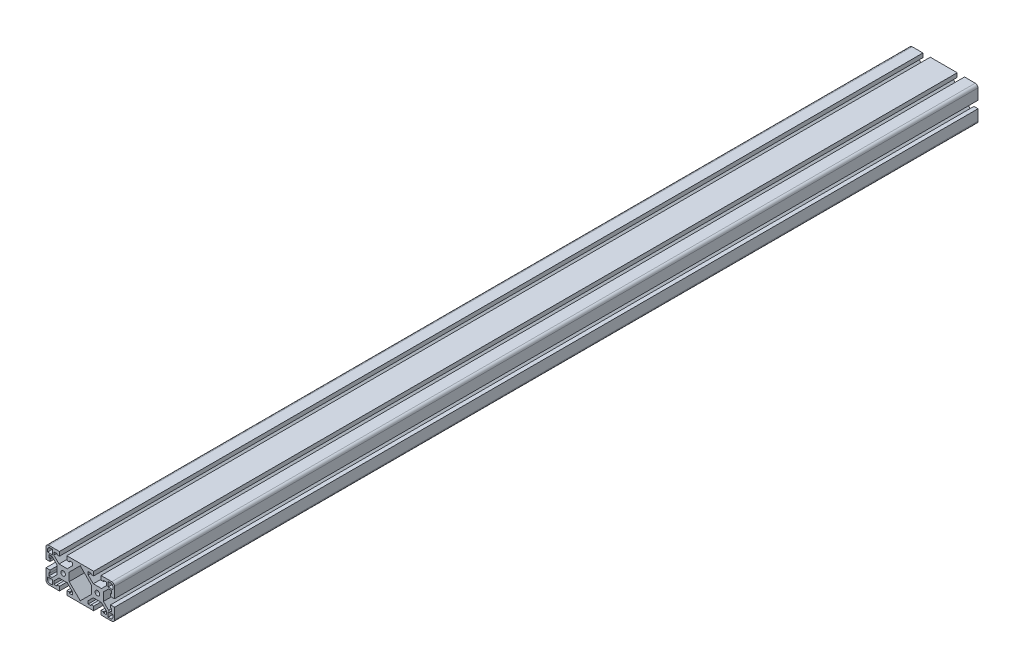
SolidWorks part; units mm, degrees
ref_plane "Front" through (0, 0, 0) normal (0, 0, 1) x (1, 0, 0)
ref_plane "Top" through (0, 0, 0) normal (0, 1, 0) x (1, 0, 0)
ref_plane "Right" through (0, 0, 0) normal (1, 0, 0) x (0, 0, -1)
sketch "Sketch1" plane through (0, 0, 0) normal (0, 0, 1) x (1, 0, 0)
  line L0 (-12.319, 4.5757) -> (-12.319, -4.5757)
  line L1 (0, 16.8947) -> (-12.319, 4.5757)
  line L2 (12.319, 4.5757) -> (0, 16.8947)
  line L3 (12.319, -4.5757) -> (12.319, 4.5757)
  line L4 (0, -16.8947) -> (12.319, -4.5757)
  line L5 (-12.319, -4.5757) -> (0, -16.8947)
  line L6 (-30.9372, 11.8872) -> (-30.9372, 17.272)
  line L7 (-36.322, 11.8872) -> (-30.9372, 11.8872)
  line L8 (-36.322, 14.478) -> (-36.322, 11.8872)
  line L9 (-30.9372, 17.272) -> (-33.528, 17.272)
  line L10 (-30.9372, -17.272) -> (-30.9372, -11.8872)
  line L11 (-33.528, -17.272) -> (-30.9372, -17.272)
  line L12 (-36.322, -11.8872) -> (-36.322, -14.478)
  line L13 (-30.9372, -11.8872) -> (-36.322, -11.8872)
  line L14 (36.322, -11.8872) -> (30.9372, -11.8872)
  line L15 (36.322, -14.478) -> (36.322, -11.8872)
  line L16 (30.9372, -17.272) -> (33.528, -17.272)
  line L17 (30.9372, -11.8872) -> (30.9372, -17.272)
  line L18 (30.9372, 17.272) -> (30.9372, 11.8872)
  line L19 (33.528, 17.272) -> (30.9372, 17.272)
  line L20 (36.322, 11.8872) -> (36.322, 14.478)
  line L21 (30.9372, 11.8872) -> (36.322, 11.8872)
  line L22 (-29.337, 12.4423) -> (-29.337, 15.6718)
  line L23 (-29.337, 15.6718) -> (-25.908, 15.6718)
  line L24 (-25.908, 15.6718) -> (-25.908, 14.5034)
  line L25 (-25.908, 14.5034) -> (-23.114, 14.5034)
  line L26 (-23.114, 14.5034) -> (-23.114, 19.05)
  line L27 (-23.114, 19.05) -> (-35.052, 19.05)
  line L28 (-38.1, 16.002) -> (-38.1, 4.064)
  line L29 (-38.1, 4.064) -> (-33.5534, 4.064)
  line L30 (-33.5534, 4.064) -> (-33.5534, 6.858)
  line L31 (-33.5534, 6.858) -> (-34.7218, 6.858)
  line L32 (-34.7218, 6.858) -> (-34.7218, 10.287)
  line L33 (-34.7218, 10.287) -> (-31.4923, 10.287)
  line L34 (-31.4923, 10.287) -> (-25.781, 4.5757)
  line L35 (-25.781, 4.5757) -> (-25.781, -4.5757)
  line L36 (-25.781, -4.5757) -> (-31.4923, -10.287)
  line L37 (-31.4923, -10.287) -> (-34.7218, -10.287)
  line L38 (-34.7218, -10.287) -> (-34.7218, -6.858)
  line L39 (-34.7218, -6.858) -> (-33.5534, -6.858)
  line L40 (-33.5534, -6.858) -> (-33.5534, -4.064)
  line L41 (-33.5534, -4.064) -> (-38.1, -4.064)
  line L42 (-38.1, -4.064) -> (-38.1, -16.002)
  line L43 (-35.052, -19.05) -> (-23.114, -19.05)
  line L44 (-23.114, -19.05) -> (-23.114, -14.5034)
  line L45 (-23.114, -14.5034) -> (-25.908, -14.5034)
  line L46 (-25.908, -14.5034) -> (-25.908, -15.6718)
  line L47 (-25.908, -15.6718) -> (-29.337, -15.6718)
  line L48 (-29.337, -15.6718) -> (-29.337, -12.4423)
  line L49 (-29.337, -12.4423) -> (-23.6257, -6.731)
  line L50 (-23.6257, -6.731) -> (-14.4743, -6.731)
  line L51 (-14.4743, -6.731) -> (-8.763, -12.4423)
  line L52 (-8.763, -12.4423) -> (-8.763, -15.6718)
  line L53 (-8.763, -15.6718) -> (-12.192, -15.6718)
  line L54 (-12.192, -15.6718) -> (-12.192, -14.5034)
  line L55 (-12.192, -14.5034) -> (-14.986, -14.5034)
  line L56 (-14.986, -14.5034) -> (-14.986, -19.05)
  line L57 (-14.986, -19.05) -> (14.986, -19.05)
  line L58 (14.986, -19.05) -> (14.986, -14.5034)
  line L59 (14.986, -14.5034) -> (12.192, -14.5034)
  line L60 (12.192, -14.5034) -> (12.192, -15.6718)
  line L61 (12.192, -15.6718) -> (8.763, -15.6718)
  line L62 (8.763, -15.6718) -> (8.763, -12.4423)
  line L63 (8.763, -12.4423) -> (14.4743, -6.731)
  line L64 (14.4743, -6.731) -> (23.6257, -6.731)
  line L65 (23.6257, -6.731) -> (29.337, -12.4423)
  line L66 (29.337, -12.4423) -> (29.337, -15.6718)
  line L67 (29.337, -15.6718) -> (25.908, -15.6718)
  line L68 (25.908, -15.6718) -> (25.908, -14.5034)
  line L69 (25.908, -14.5034) -> (23.114, -14.5034)
  line L70 (23.114, -14.5034) -> (23.114, -19.05)
  line L71 (23.114, -19.05) -> (35.052, -19.05)
  line L72 (38.1, -16.002) -> (38.1, -4.064)
  line L73 (38.1, -4.064) -> (33.5534, -4.064)
  line L74 (33.5534, -4.064) -> (33.5534, -6.858)
  line L75 (33.5534, -6.858) -> (34.7218, -6.858)
  line L76 (34.7218, -6.858) -> (34.7218, -10.287)
  line L77 (34.7218, -10.287) -> (31.4923, -10.287)
  line L78 (31.4923, -10.287) -> (25.781, -4.5757)
  line L79 (25.781, -4.5757) -> (25.781, 4.5757)
  line L80 (25.781, 4.5757) -> (31.4923, 10.287)
  line L81 (31.4923, 10.287) -> (34.7218, 10.287)
  line L82 (34.7218, 10.287) -> (34.7218, 6.858)
  line L83 (34.7218, 6.858) -> (33.5534, 6.858)
  line L84 (33.5534, 6.858) -> (33.5534, 4.064)
  line L85 (33.5534, 4.064) -> (38.1, 4.064)
  line L86 (38.1, 4.064) -> (38.1, 16.002)
  line L87 (35.052, 19.05) -> (23.114, 19.05)
  line L88 (23.114, 19.05) -> (23.114, 14.5034)
  line L89 (23.114, 14.5034) -> (25.908, 14.5034)
  line L90 (25.908, 14.5034) -> (25.908, 15.6718)
  line L91 (25.908, 15.6718) -> (29.337, 15.6718)
  line L92 (29.337, 15.6718) -> (29.337, 12.4423)
  line L93 (29.337, 12.4423) -> (23.6257, 6.731)
  line L94 (23.6257, 6.731) -> (14.4743, 6.731)
  line L95 (14.4743, 6.731) -> (8.763, 12.4423)
  line L96 (8.763, 12.4423) -> (8.763, 15.6718)
  line L97 (8.763, 15.6718) -> (12.192, 15.6718)
  line L98 (12.192, 15.6718) -> (12.192, 14.5034)
  line L99 (12.192, 14.5034) -> (14.986, 14.5034)
  line L100 (14.986, 14.5034) -> (14.986, 19.05)
  line L101 (14.986, 19.05) -> (-14.986, 19.05)
  line L102 (-14.986, 19.05) -> (-14.986, 14.5034)
  line L103 (-14.986, 14.5034) -> (-12.192, 14.5034)
  line L104 (-12.192, 14.5034) -> (-12.192, 15.6718)
  line L105 (-12.192, 15.6718) -> (-8.763, 15.6718)
  line L106 (-8.763, 15.6718) -> (-8.763, 12.4423)
  line L107 (-8.763, 12.4423) -> (-14.4743, 6.731)
  line L108 (-14.4743, 6.731) -> (-23.6257, 6.731)
  line L109 (-23.6257, 6.731) -> (-29.337, 12.4423)
  circle A0 centre (-19.05, 0) radius 2.5527
  circle A1 centre (19.05, 0) radius 2.5527
  arc A2 (-35.052, 19.05) -> (-38.1, 16.002) centre (-35.052, 16.002) ccw
  arc A3 (-38.1, -16.002) -> (-35.052, -19.05) centre (-35.052, -16.002) ccw
  arc A4 (35.052, -19.05) -> (38.1, -16.002) centre (35.052, -16.002) ccw
  arc A5 (38.1, 16.002) -> (35.052, 19.05) centre (35.052, 16.002) ccw
  arc A6 (-33.528, 17.272) -> (-36.322, 14.478) centre (-33.528, 14.478) ccw
  arc A7 (-36.322, -14.478) -> (-33.528, -17.272) centre (-33.528, -14.478) ccw
  arc A8 (33.528, -17.272) -> (36.322, -14.478) centre (33.528, -14.478) ccw
  arc A9 (36.322, 14.478) -> (33.528, 17.272) centre (33.528, 14.478) ccw
extrude "Boss-Extrude1" add sketch "Sketch1" along normal mid plane 960.247
sketch "Sketch2" plane through (0, 0, 480.1235) normal (0, 0, 1) x (1, 0, 0)
  line L0 (14.986, 19.05) -> (-14.986, 19.05) construction
  line L1 (-38.1, 19.05) -> (0, 19.05)
  line L2 (-38.1, 19.05) -> (-38.1, -19.05)
  line L3 (-38.1, -19.05) -> (0, -19.05)
  line L4 (0, 19.05) -> (0, -19.05)
  line L5 (-23.114, 19.05) -> (-35.052, 19.05) construction
  line L6 (-38.1, 16.002) -> (-38.1, 4.064) construction
  line L7 (-14.986, -19.05) -> (14.986, -19.05) construction
  point P6 (0, 19.05)
